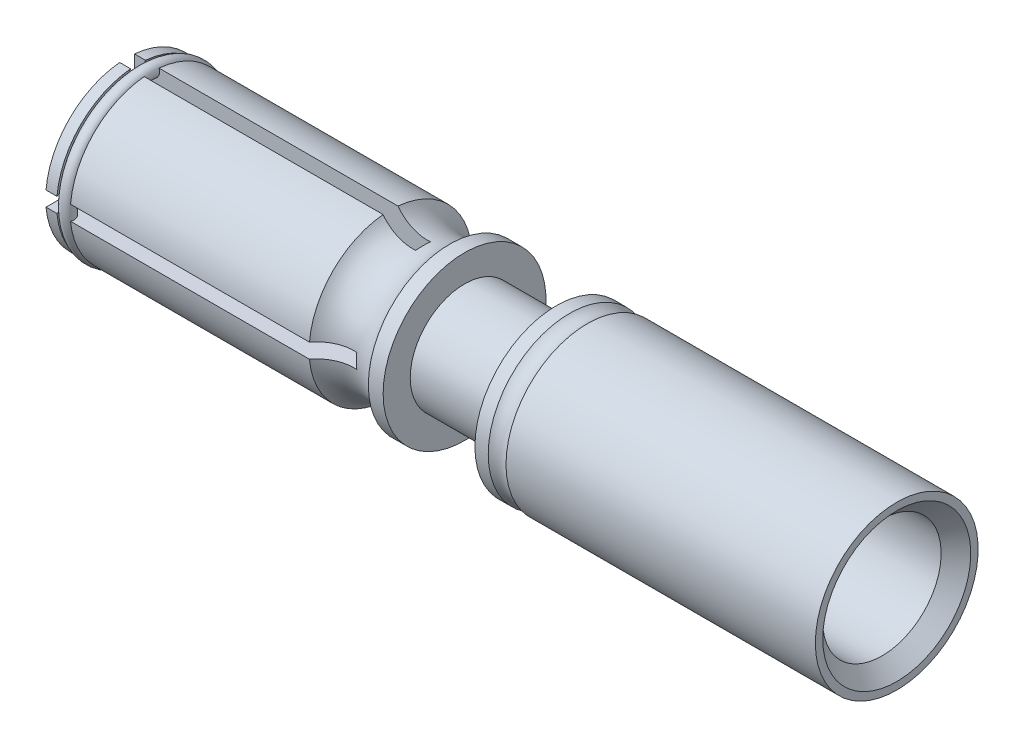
SolidWorks part; units mm, degrees
ref_plane "Plan1" through (0, 0, 0) normal (0, 0, 1) x (1, 0, 0)
ref_plane "Plan2" through (0, 0, 0) normal (0, 1, 0) x (1, 0, 0)
ref_plane "Plan3" through (0, 0, 0) normal (1, 0, 0) x (0, 0, -1)
sketch "Esquisse1" plane through (0, 0, 0) normal (0, 0, 1) x (1, 0, 0)
  line L0 (-32, 5.5) -> (-31.2583, 5.5)
  line L1 (-9.2, 5.5) -> (-9.2, 3.67)
  line L2 (-9.2, 3.67) -> (-3, 3.67)
  line L3 (-3, 3.67) -> (-3, 5.5)
  line L4 (-3, 5.5) -> (-2.1, 5.5)
  line L5 (20, 5.5) -> (20, 5)
  line L6 (20, 5) -> (19, 4)
  line L7 (19, 4) -> (0, 4)
  line L8 (0, 4) -> (-1, 0)
  line L9 (-1, 0) -> (-10, 0)
  line L10 (-32, 5.5) -> (-32, 4)
  line L11 (-32, 4) -> (-31, 3)
  line L12 (-31, 3) -> (-11, 3)
  line L13 (-0.9, 5.5) -> (20, 5.5)
  line L14 (-58, 0) -> (56, 0) construction
  line L15 (-11, 3) -> (-10, 0)
  line L16 (-10.2, 5.5) -> (-9.2, 5.5)
  line L17 (-30.3417, 5.5) -> (-14.2, 5.5)
  arc A0 (-2.1, 5.5) -> (-0.9, 5.5) centre (-1.5, 6.3) ccw
  arc A1 (-14.2, 5.5) -> (-10.2, 5.5) centre (-12.2, 7) ccw
  arc A2 (-31.2583, 5.5) -> (-30.3417, 5.5) centre (-30.8, 5.3) ccw
  dimension "D16" = 2
  dimension "D19" = 5
  dimension "D20" = 1
  dimension "D1" = 6.2
  dimension "D2" = 1
  dimension "D3" = 1
  dimension "D4" = 23
  dimension "D5" = 52
  dimension "D6" = 21
  dimension "D7" = 1
  dimension "D8" = 4
  dimension "D9" = 5.5
  dimension "D10" = 3.67
  dimension "D11" = 1
  dimension "D12" = 3
  dimension "D13" = 22
  dimension "D14" = 0.8
  dimension "D15" = 1.5
  dimension "D17" = 1.5
  dimension "D18" = 3
  dimension "D21" = 0.2
  dimension "D22" = 1.2
  dimension "D23" = 5.5
revolve "Base-Révolution" add sketch "Esquisse1" angle 360 about L14
sketch "Esquisse2" plane through (-32, 0, 0) normal (-1, 0, 0) x (0, 0, 1)
  line L0 (0.5, 0.5) -> (7.5, 0.5)
  line L1 (-0.5, 6) -> (0.5, 6)
  line L2 (-0.5, 6) -> (-0.5, 0.5)
  line L3 (-0.5, -6) -> (0.5, -6)
  line L4 (0.5, 6) -> (0.5, 0.5)
  line L5 (-6.5, 0.5) -> (-0.5, 0.5)
  line L6 (-6.5, 0.5) -> (-6.5, -0.5)
  line L7 (-6.5, -0.5) -> (-0.5, -0.5)
  line L8 (7.5, 0.5) -> (7.5, -0.5)
  line L9 (-0.5, -0.5) -> (-0.5, -6)
  line L10 (0.5, -0.5) -> (7.5, -0.5)
  line L11 (0.5, -0.5) -> (0.5, -6)
  dimension "D1" = 0.5
  dimension "D2" = 1
  dimension "D3" = 0.5
  dimension "D4" = 1
extrude "Enlèv. mat.-Extru.1" cut sketch "Esquisse2" against normal blind 20
sketch "Esquisse3" plane through (0, 0, 0) normal (0, 1, 0) x (1, 0, 0)
  line L0 (-33, 0) -> (-30, 0) construction
  line L1 (-58, 0) -> (56, 0) construction
  line L2 (-32, 5.4772) -> (-32, 0.5) construction
  circle A0 centre (-30.8, 5.2) radius 0.45
  dimension "D1" = 0.9
  dimension "D2" = 5.2
  dimension "D3" = 1.2
revolve "Boss.-Révol.1" add sketch "Esquisse3" angle 350 about L0
